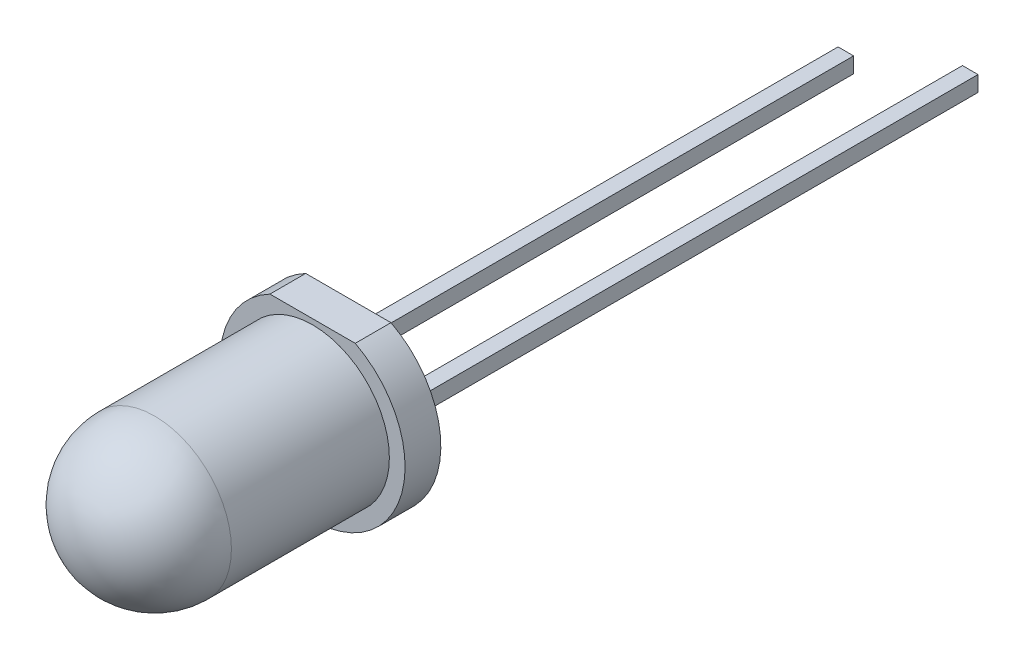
SolidWorks part; units mm, degrees
ref_plane "Front Plane" through (0, 0, 0) normal (0, 0, 1) x (1, 0, 0)
ref_plane "Top Plane" through (0, 0, 0) normal (0, 1, 0) x (1, 0, 0)
ref_plane "Right Plane" through (0, 0, 0) normal (1, 0, 0) x (0, 0, -1)
sketch "Sketch1" plane through (0, 0, 0) normal (0, 0, 1) x (1, 0, 0)
  circle A0 centre (0, 0) radius 2.975
  dimension "D1" = 5.95
extrude "Extrude1" add sketch "Sketch1" along normal mid plane 1.15
sketch "Sketch2" plane through (0, 0, 0.575) normal (0, 0, 1) x (1, 0, 0)
  circle A0 centre (0, 0) radius 2.47
  dimension "D1" = 4.94
extrude "Extrude2" add sketch "Sketch2" along normal blind 7.55
fillet "Fillet2" radius 2.47 1 edges at (2.47, 0, 8.125)
ref_plane "Plane1" through (0, 3, 0) normal (0, 1, 0) x (-1, 0, 0)
sketch "Sketch4" plane through (0, 3, 0) normal (0, 1, 0) x (-1, 0, 0)
  line L1 (4.5989, -2.7325) -> (-8.4821, -2.7325)
  line L2 (4.5989, -2.7325) -> (4.5989, 3.078)
  line L3 (4.5989, 3.078) -> (-8.4821, 3.078)
  line L4 (-8.4821, -2.7325) -> (-8.4821, 3.078)
extrude "Extrude3" cut sketch "Sketch4" against normal blind 0.36
ref_plane "Plane2" through (0, 0, -0.575) normal (0, 0, -1) x (-1, 0, 0)
sketch "Sketch5" plane through (0, 0, -0.575) normal (0, 0, -1) x (-1, 0, 0)
  line L1 (-0.25, 1.51) -> (0.25, 1.51)
  line L2 (-0.25, 1.51) -> (-0.25, 1.01)
  line L3 (-0.25, 1.01) -> (0.25, 1.01)
  line L4 (0.25, 1.51) -> (0.25, 1.01)
  line L5 (-0.25, -1.01) -> (0.25, -1.01)
  line L6 (-0.25, -1.01) -> (-0.25, -1.51)
  line L7 (-0.25, -1.51) -> (0.25, -1.51)
  line L8 (0.25, -1.01) -> (0.25, -1.51)
  dimension "D1" = 0.5
  dimension "D2" = 0.5
  dimension "D3" = 2.02
  dimension "D4" = 1.01
  dimension "D5" = 0.5
  dimension "D6" = 0.5
  dimension "D7" = 0.25
  dimension "D8" = 0.25
extrude "Extrude4" add sketch "Sketch5" along normal blind 20
sketch "Sketch6" plane through (0, 0, -20.575) normal (0, 0, -1) x (-1, 0, 0)
  line L1 (-0.25, 1.51) -> (0.25, 1.51)
  line L2 (-0.25, 1.51) -> (-0.25, 1.01)
  line L3 (-0.25, 1.01) -> (0.25, 1.01)
  line L4 (0.25, 1.51) -> (0.25, 1.01)
extrude "Extrude5" cut sketch "Sketch6" against normal blind 4
